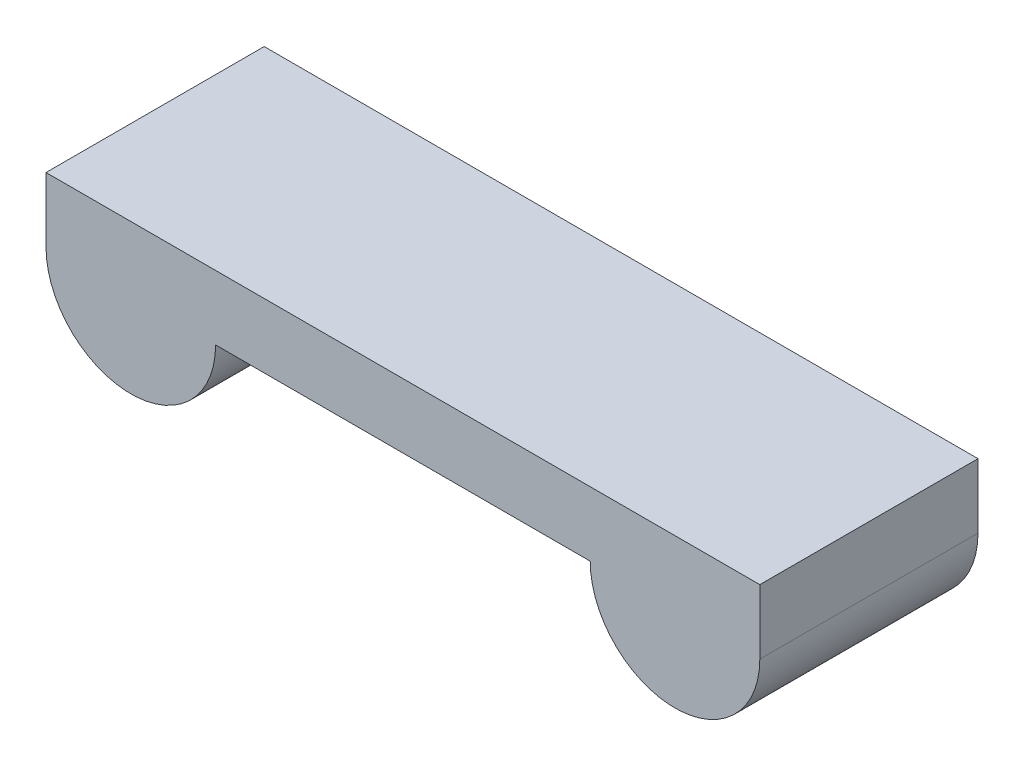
SolidWorks part; units mm, degrees
ref_plane "Ebene1" through (0, 0, 0) normal (0, 0, 1) x (1, 0, 0)
ref_plane "Ebene2" through (0, 0, 0) normal (0, 1, 0) x (1, 0, 0)
ref_plane "Ebene3" through (0, 0, 0) normal (1, 0, 0) x (0, 0, -1)
sketch "Skizze1" plane through (0, 0, 0) normal (0, 0, 1) x (1, 0, 0)
  line L0 (-49.0772, 0) -> (49.0772, 0)
  line L1 (49.0772, 0) -> (49.0772, -8.8679)
  line L2 (25.7534, -8.8679) -> (-25.7534, -8.8679)
  line L3 (-49.0772, -8.8679) -> (-49.0772, 0)
  line L4 (0, 0) -> (0, -8.8679) construction
  arc A0 (49.0772, -8.8679) -> (25.7534, -8.8679) centre (37.4153, -8.8679) cw
  arc A1 (-25.7534, -8.8679) -> (-49.0772, -8.8679) centre (-37.4153, -8.8679) cw
extrude "Linear austragen1" add sketch "Skizze1" along normal mid plane 30
